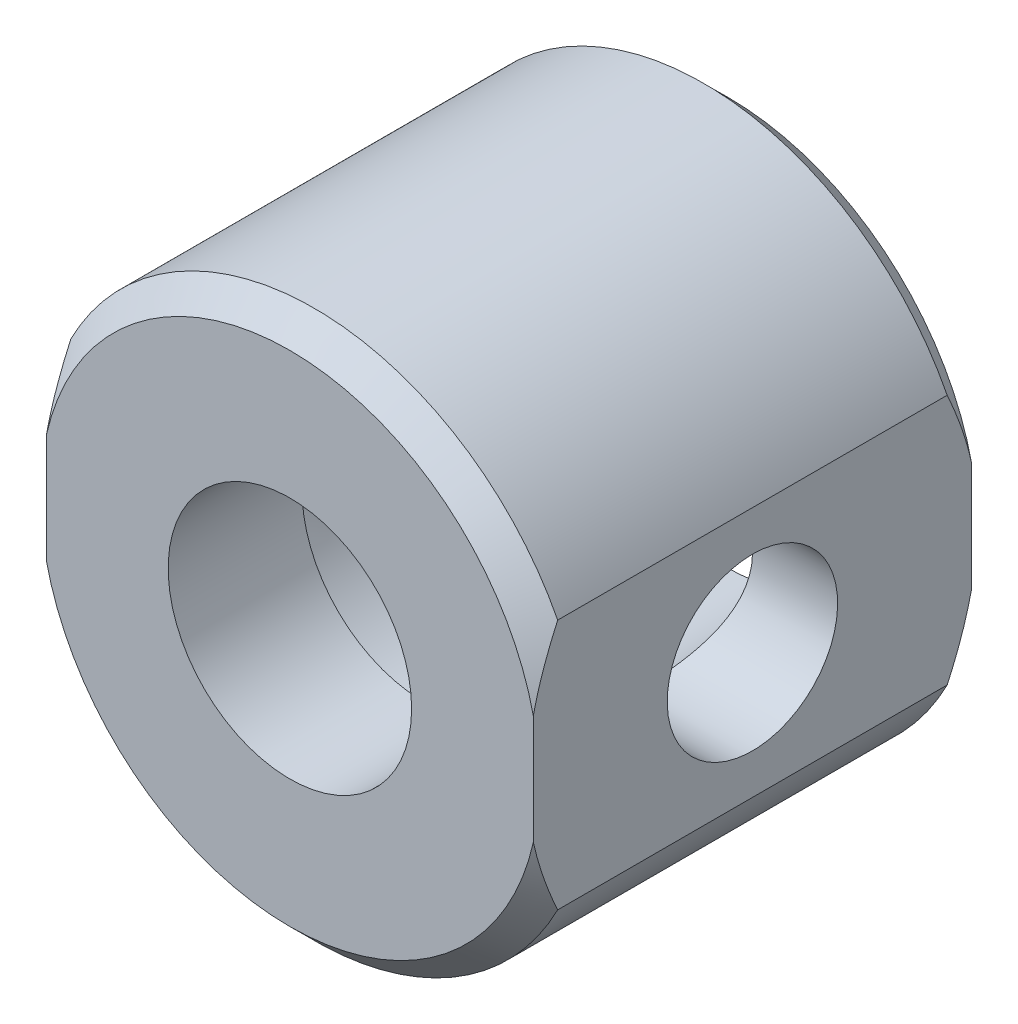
SolidWorks part; units mm, degrees
ref_plane "Face" through (0, 0, 0) normal (0, 0, 1) x (1, 0, 0)
ref_plane "Dessus" through (0, 0, 0) normal (0, 1, 0) x (1, 0, 0)
ref_plane "Droite" through (0, 0, 0) normal (1, 0, 0) x (0, 0, -1)
sketch "Esquisse1" plane through (0, 0, 0) normal (0, 0, 1) x (1, 0, 0)
  circle A0 centre (0, 0) radius 22.5
  dimension "D1" = 45
extrude "Base-Extrusion" add sketch "Esquisse1" along normal blind 36
sketch "Esquisse2" plane through (0, 0, 0) normal (0, 0, 1) x (1, 0, 0)
  circle A0 centre (0, 0) radius 13
  dimension "D1" = 26
extrude "Enlèv. mat.-Extru.1" cut sketch "Esquisse2" along normal blind 25
sketch "Esquisse3" plane through (0, 0, 36) normal (0, 0, 1) x (1, 0, 0)
  circle A0 centre (0, 0) radius 10
  dimension "D1" = 20
extrude "Enlèv. mat.-Extru.2" cut sketch "Esquisse3" against normal through all
chamfer "Chanfrein1" distance 2 distance2 2
chamfer "Chanfrein2" distance 2 angle 45
sketch "Esquisse5" plane through (0, 0, 0) normal (0, 0, -1) x (-1, 0, 0)
  line L0 (20, -21.5228) -> (20, 24.0303)
  line L1 (20, 24.0303) -> (-20, 24.0303)
  line L2 (-20, 24.0303) -> (-20, -21.5228)
  line L3 (-20, -21.5228) -> (-28.1184, -21.5228)
  line L4 (-28.1184, -21.5228) -> (-28.1184, 26.5109)
  line L5 (-28.1184, 26.5109) -> (26.1639, 26.5109)
  line L6 (26.1639, 26.5109) -> (26.1639, -20.9214)
  line L7 (26.1639, -20.9214) -> (20, -21.5228)
  line L8 (0, 0) -> (0, 20.9483) construction
  dimension "D1" = 20
  dimension "D2" = 20
extrude "Enlèv. mat.-Extru.7" cut sketch "Esquisse5" against normal through all
sketch "Esquisse6" plane through (20, 0, 0) normal (1, 0, 0) x (0, 0, -1)
  line L0 (0, 0) -> (-36, 0) construction
  line L1 (-34, 0) -> (-2, 0) construction
  line L2 (0, -4.5) -> (0, 4.5) construction
  circle A0 centre (-18, 0) radius 7
  dimension "D1" = 14
  dimension "D2" = 18
extrude "Enlèv. mat.-Extru.8" cut sketch "Esquisse6" against normal through all
